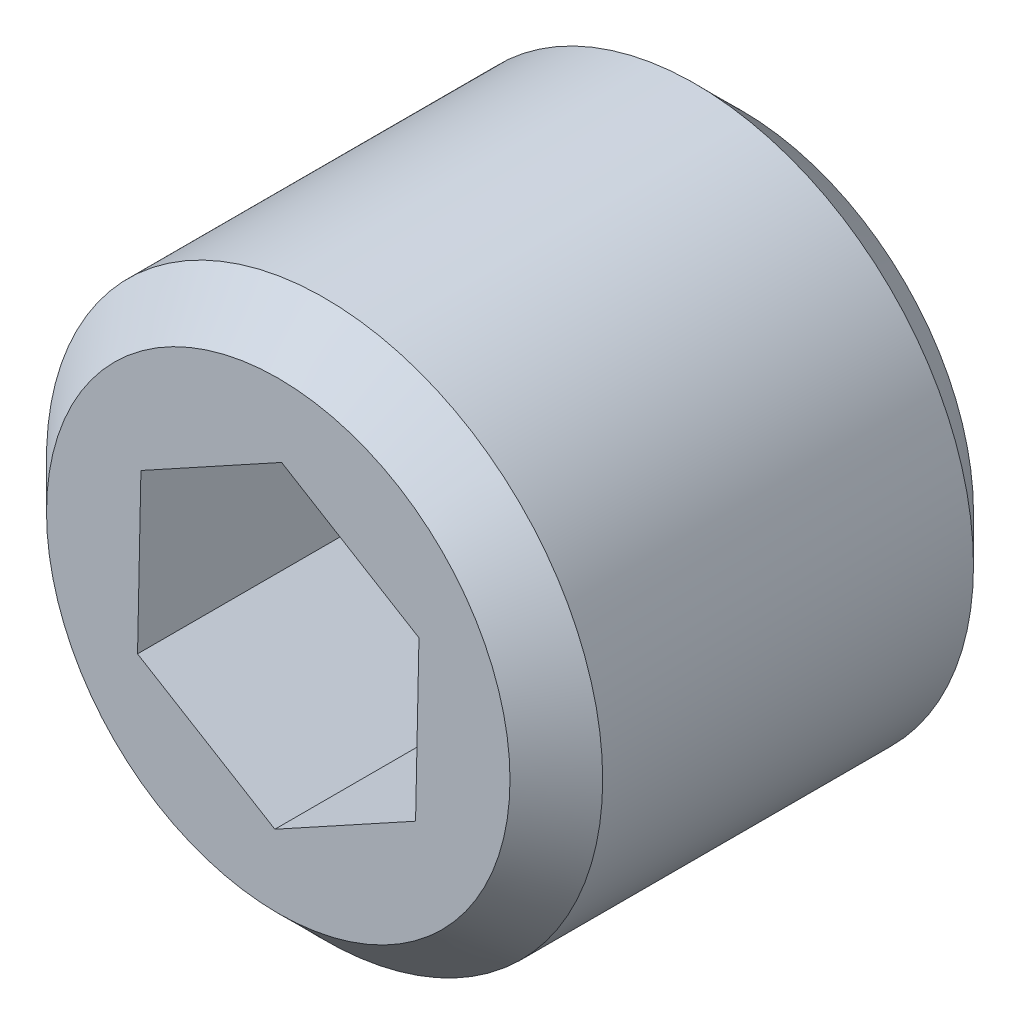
SolidWorks part; units mm, degrees
ref_plane "Alzado" through (0, 0, 0) normal (0, 0, 1) x (1, 0, 0)
ref_plane "Planta" through (0, 0, 0) normal (0, 1, 0) x (1, 0, 0)
ref_plane "Vista lateral" through (0, 0, 0) normal (1, 0, 0) x (0, 0, -1)
sketch "Croquis1" plane through (0, 0, 0) normal (0, 0, 1) x (1, 0, 0)
  circle A0 centre (0, 0) radius 6
  dimension "D1" = 12
extrude "Saliente-Extruir1" add sketch "Croquis1" along normal blind 10
sketch "Croquis2" plane through (0, 0, 10) normal (0, 0, 1) x (1, 0, 0)
  line L1 (-2.9628, 1.795) -> (-3.0359, -1.6683)
  line L2 (-3.0359, -1.6683) -> (-0.0731, -3.4633)
  line L3 (-0.0731, -3.4633) -> (2.9628, -1.795)
  line L4 (2.9628, -1.795) -> (3.0359, 1.6683)
  line L5 (3.0359, 1.6683) -> (0.0731, 3.4633)
  line L6 (0.0731, 3.4633) -> (-2.9628, 1.795)
  circle A0 centre (0, 0) radius 3 construction
  dimension "D1" = 6
extrude "Cortar-Extruir1" cut sketch "Croquis2" against normal blind 5
chamfer "Chaflán1" distance 1 angle 45 2 edges at (6, 0, 0) (6, 0, 10)
